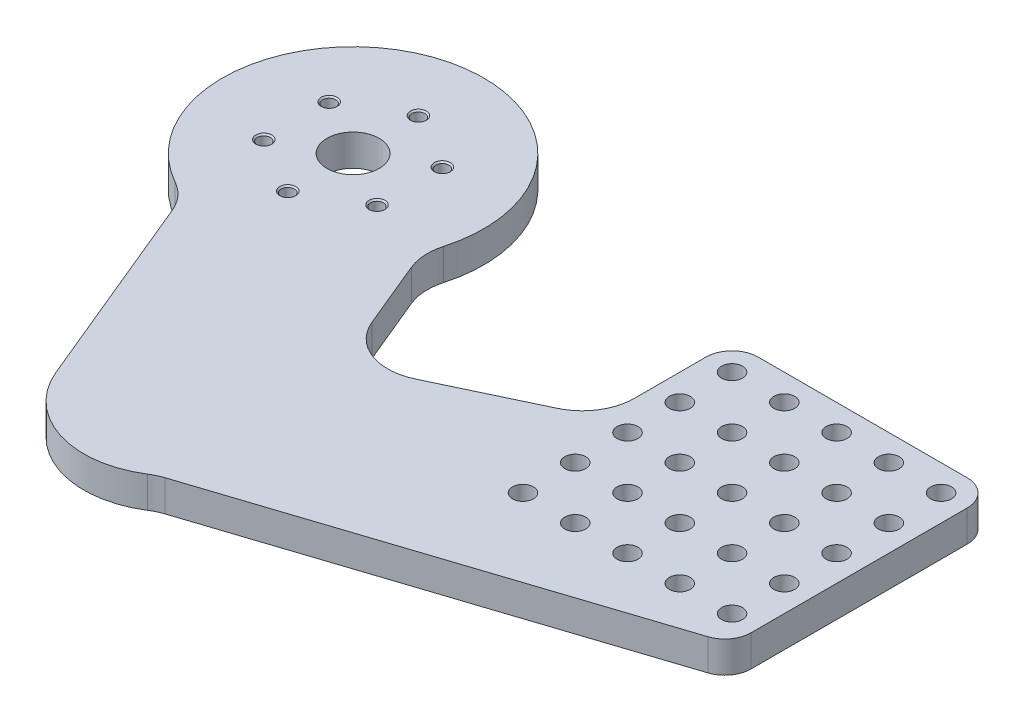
SolidWorks part; units mm, degrees
ref_plane "Front Plane" through (0, 0, 0) normal (0, 0, 1) x (1, 0, 0)
ref_plane "Top Plane" through (0, 0, 0) normal (0, 1, 0) x (1, 0, 0)
ref_plane "Right Plane" through (0, 0, 0) normal (1, 0, 0) x (0, 0, -1)
sketch "Sketch1" plane through (0, 0, 0) normal (0, 1, 0) x (1, 0, 0)
  line L0 (0, -25) -> (0, 20)
  line L1 (-25, 25) -> (25, 25)
  line L2 (-25, 25) -> (-25, -25)
  line L3 (-25, -25) -> (25, -25)
  line L4 (25, 25) -> (25, -25)
  line L5 (-25, 25) -> (25, -25) construction
  line L6 (-25, -25) -> (25, 25) construction
  line L7 (0, 20) -> (-25, 20)
  line L8 (-25, 20) -> (-92.5, 20)
  line L9 (-92.5, 20) -> (-75.2792, -21.5746)
  line L10 (-75.2792, -21.5746) -> (-69.3361, -35.9227)
  line L11 (-68.4521, -55.5568) -> (25, -25)
  line L12 (-76.3321, 26.697) -> (-108.6679, 13.303)
  line L13 (-108.6679, 13.303) -> (-84.62, -44.7537)
  line L14 (-76.3321, 26.697) -> (-52.2842, -31.3598)
  line L15 (-84.62, -44.7537) -> (-52.2842, -31.3598)
  line L16 (-68.4521, -20.5568) -> (-25, 0)
  line L17 (-25, 0) -> (25, -25)
  line L18 (-46.7261, -10.2784) -> (-32.7998, -43.8993)
  line L19 (-32.7998, -43.8993) -> (-25, -25)
  circle A0 centre (-92.5, 20) radius 25
  circle A1 centre (-68.4521, -38.0568) radius 17.5
  point P0 (0, 0)
  point P16 (-92.5, 20)
  dimension "D4" = 67.5
  dimension "D1" = 50
  dimension "D2" = 50
  dimension "D3" = 67.5
  dimension "D5" = 35
extrude "Boss-Extrude1" add sketch "Sketch1" along normal blind 6
sketch "Sketch2" plane through (0, 6, 0) normal (0, 1, 0) x (1, 0, 0)
  line L1 (-20, 20) -> (20, 20)
  line L2 (-20, 20) -> (-20, -20)
  line L3 (-20, -20) -> (20, -20)
  line L4 (20, 20) -> (20, -20)
  line L5 (-20, 20) -> (20, -20) construction
  line L6 (-20, -20) -> (20, 20) construction
  circle A0 centre (-20, -20) radius 2
  circle A1 centre (-10, -20) radius 2
  circle A2 centre (0, -20) radius 2
  circle A3 centre (10, -20) radius 2
  circle A4 centre (20, -20) radius 2
  circle A5 centre (-10, -10) radius 2
  circle A6 centre (0, -10) radius 2
  circle A7 centre (10, -10) radius 2
  circle A8 centre (20, -10) radius 2
  circle A9 centre (-10, 0) radius 2
  circle A10 centre (0, 0) radius 2
  circle A11 centre (10, 0) radius 2
  circle A12 centre (20, 0) radius 2
  circle A13 centre (-10, 10) radius 2
  circle A14 centre (0, 10) radius 2
  circle A15 centre (10, 10) radius 2
  circle A16 centre (20, 10) radius 2
  circle A17 centre (-10, 20) radius 2
  circle A18 centre (0, 20) radius 2
  circle A19 centre (10, 20) radius 2
  circle A20 centre (20, 20) radius 2
  circle A21 centre (-20, -10) radius 2
  circle A22 centre (-20, 0) radius 2
  circle A23 centre (-20, 10) radius 2
  circle A24 centre (-20, 20) radius 2
  point P0 (0, 0)
  dimension "D3" = 5
  dimension "D1" = 40
  dimension "D2" = 40
  dimension "D4" = 5
extrude "Cut-Extrude1" cut sketch "Sketch2" against normal blind 10 contours A4 | A0 | A24 | A20 | A1 | A2 | A3 | A8 | A7 | A6 | A5 | A21 | A22 | A23 | A13 | A9 | A10 | A14 | A18 | A17 | A19 | A15 | A11 | A12 | A16
fillet "Fillet5" radius 5 3 edges at (25, 3, 25) (25, 3, -25) (-25, 3, -25)
fillet "Fillet6" radius 10 5 edges at (-69.4998, 3, -10.2024) (-101.8356, 3, 3.1915) (-25, 3, 0) (-58.6749, 3, 15.9313) (-58.1133, 3, 52.1762)
sketch "Sketch5" plane through (0, 6, 0) normal (0, 1, 0) x (1, 0, 0)
  circle A0 centre (-92.5, 20) radius 12.5
  circle A1 centre (-92.5, 32.5) radius 1.2
  circle A2 centre (-81.6747, 26.25) radius 1.2
  circle A3 centre (-92.5, 20) radius 12.5
  circle A4 centre (-81.6747, 13.75) radius 1.2
  circle A5 centre (-92.5, 20) radius 12.5
  circle A6 centre (-92.5, 7.5) radius 1.2
  circle A7 centre (-92.5, 20) radius 12.5
  circle A8 centre (-103.3253, 13.75) radius 1.2
  circle A9 centre (-92.5, 20) radius 12.5
  circle A10 centre (-103.3253, 26.25) radius 1.2
  circle A11 centre (-92.5, 20) radius 12.5
  point P3 (-92.5, 32.5)
  point P9 (-81.6747, 26.25)
  point P12 (-81.6747, 13.75)
  point P15 (-92.5, 7.5)
  point P18 (-103.3253, 13.75)
  point P21 (-103.3253, 26.25)
  dimension "D1" = 6
hole_wizard "M3 Tapped Hole1" positions "Sketch5" profile "Sketch6" tap size "M3" standard "ISO"
sketch "Sketch6" plane through (-103.3253, 6, -26.25) normal (1, 0, 0) x (0, 0, 1)
  line L0 (0, 0) -> (0, 6)
  line L1 (0, 6) -> (1.25, 6)
  line L2 (1.25, 6) -> (1.25, 0.275)
  line L3 (1.25, 0.275) -> (1.525, 0)
  line L5 (1.525, 0) -> (0, 0)
  line L6 (-1.25, 0.275) -> (-1.525, 0) construction
  line L11 (0, -6.35) -> (0, 107.95) construction
  dimension "Thru Tap Drill Dia." = 2.5
  dimension "Thru Tap Drill Depth" = 6
  dimension "Near C'Sink Dia." = 3.05
  dimension "Near C'Sink Angle" = 90
sketch "Sketch7" plane through (0, 6, 0) normal (0, 1, 0) x (1, 0, 0)
  circle A0 centre (-92.5, 20) radius 5
extrude "Cut-Extrude2" cut sketch "Sketch7" against normal blind 20.7
